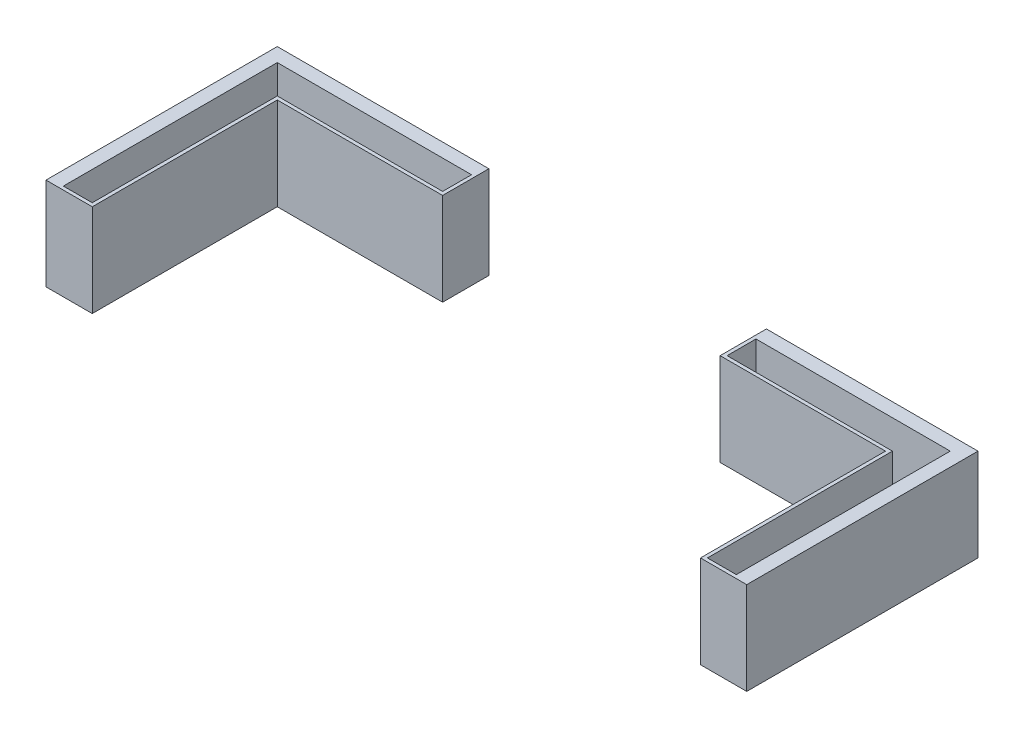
SolidWorks part; units mm, degrees
ref_plane "Alzado" through (0, 0, 0) normal (0, 0, 1) x (1, 0, 0)
ref_plane "Planta" through (0, 0, 0) normal (0, 1, 0) x (1, 0, 0)
ref_plane "Vista lateral" through (0, 0, 0) normal (1, 0, 0) x (0, 0, -1)
sketch "Croquis1" plane through (0, 0, 0) normal (0, 0, 1) x (1, 0, 0)
  line L1 (1522.4484, -491.3706) -> (607.4484, -491.3706)
  line L2 (-1507.5516, -91.3706) -> (-592.5516, -91.3706)
  line L7 (-592.5516, -491.3706) -> (-592.5516, -91.3706)
  line L8 (607.4484, -491.3706) -> (607.4484, -91.3706)
  line L9 (607.4484, -91.3706) -> (1522.4484, -91.3706)
  line L11 (-592.5516, -491.3706) -> (-1507.5516, -491.3706)
  line L12 (1522.4484, -491.3706) -> (1522.4484, -91.3706)
  line L13 (-1507.5516, -491.3706) -> (-1507.5516, -91.3706)
  point P4 (340.4849, -91.3706)
  point P12 (-1292.5516, -91.3706)
  point P14 (7.4484, 1507.346)
  point P15 (-325.5881, -91.3706)
  point P16 (1307.4484, -91.3706)
  point P18 (657.4484, -291.3706)
  point P19 (657.4484, 1058.6294)
  point P20 (7.4484, 1058.6294)
  point P21 (-642.5516, 1058.6294)
  point P22 (-642.5516, -291.3706)
extrude "Saliente-Extruir1" add sketch "Croquis1" along normal blind 60
sketch "Croquis2" plane through (0, 0, 60) normal (0, 0, 1) x (1, 0, 0)
  line L0 (607.4484, -91.3706) -> (1522.4484, -91.3706) construction
  line L1 (1522.4484, -491.3706) -> (1462.4484, -491.3706)
  line L2 (1522.4484, -491.3706) -> (1522.4484, -91.3706)
  line L3 (1522.4484, -91.3706) -> (1462.4484, -91.3706)
  line L4 (1462.4484, -491.3706) -> (1462.4484, -91.3706)
  line L5 (-1507.5516, -91.3706) -> (-592.5516, -91.3706) construction
  line L6 (-1507.5516, -491.3706) -> (-1447.5516, -491.3706)
  line L7 (-1507.5516, -491.3706) -> (-1507.5516, -91.3706)
  line L8 (-1507.5516, -91.3706) -> (-1447.5516, -91.3706)
  line L9 (-1447.5516, -491.3706) -> (-1447.5516, -91.3706)
  dimension "D1" = 60
  dimension "D2" = 60
extrude "Saliente-Extruir2" add sketch "Croquis2" along normal blind 940
sketch "Croquis4" plane through (0, -91.3706, 0) normal (0, 1, 0) x (1, 0, 0)
  line L0 (622.4484, 0) -> (622.4484, -185)
  line L1 (607.4484, 0) -> (1522.4484, 0)
  line L2 (622.4484, -185) -> (1337.4484, -185)
  line L3 (-1507.5516, -1000) -> (-1507.5516, 0)
  line L4 (1522.4484, 0) -> (1522.4484, -1000)
  line L5 (1522.4484, -1000) -> (1322.4484, -1000)
  line L6 (1522.4484, -1000) -> (1522.4484, 0)
  line L7 (1522.4484, 0) -> (1322.4484, 0)
  line L8 (1322.4484, -1000) -> (1322.4484, -200)
  line L9 (607.4484, 0) -> (1522.4484, 0)
  line L10 (607.4484, 0) -> (607.4484, -200)
  line L11 (607.4484, -200) -> (1322.4484, -200)
  line L12 (1522.4484, 0) -> (1522.4484, -200)
  line L13 (-1507.5516, 0) -> (-592.5516, 0)
  line L14 (1337.4484, -985) -> (1337.4484, -185)
  line L15 (-592.5516, 0) -> (-1507.5516, 0)
  line L16 (-592.5516, 0) -> (-592.5516, -200)
  line L17 (-592.5516, -200) -> (-1307.5516, -200)
  line L18 (-1507.5516, 0) -> (-1507.5516, -200)
  line L19 (-1507.5516, -1000) -> (-1307.5516, -1000)
  line L20 (-1507.5516, -1000) -> (-1507.5516, 0)
  line L21 (-1507.5516, 0) -> (-1307.5516, 0)
  line L22 (-1307.5516, -1000) -> (-1307.5516, -200)
  line L23 (1522.4484, -985) -> (1337.4484, -985)
  line L24 (-607.5516, 0) -> (-607.5516, -185)
  line L25 (-607.5516, -185) -> (-1322.5516, -185)
  line L26 (-1322.5516, -985) -> (-1322.5516, -185)
  line L27 (-1507.5516, -985) -> (-1322.5516, -985)
  dimension "D1" = 200
  dimension "D2" = 200
  dimension "D3" = 200
  dimension "D4" = 200
  dimension "D5" = 15
  dimension "D6" = 15
extrude "Saliente-Extruir4" add sketch "Croquis4" against normal blind 400 contours L23 L14 L2 L0 L10 L11 L8 L5 M8 M7 | L27 L3 L19 L22 L17 L16 L13 L24 L25 L26
